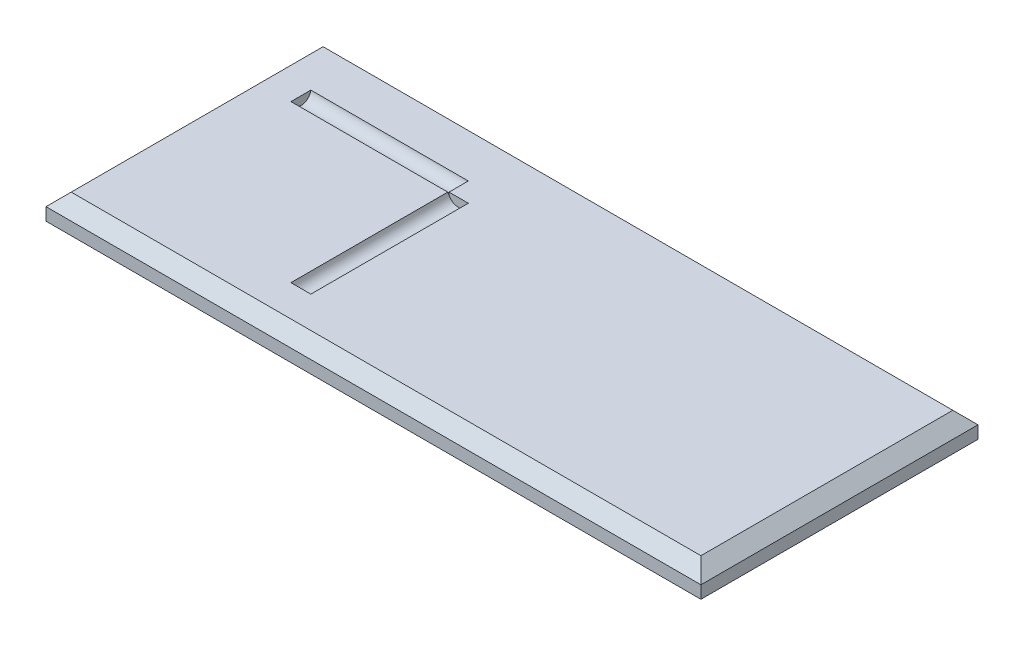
SolidWorks part; units mm, degrees
ref_plane "Front" through (0, 0, 0) normal (0, 0, 1) x (1, 0, 0)
ref_plane "Top" through (0, 0, 0) normal (0, 1, 0) x (1, 0, 0)
ref_plane "Right" through (0, 0, 0) normal (1, 0, 0) x (0, 0, -1)
sketch "Sketch1" plane through (0, 0, 0) normal (0, 0, 1) x (1, 0, 0)
  line L0 (0, 0) -> (330.2, 0)
  line L1 (0, 0) -> (0, 12.7)
  line L2 (330.2, 12.7) -> (0, 12.7)
  line L3 (330.2, 12.7) -> (330.2, 0)
  dimension "D1" = 330.2
  dimension "D2" = 12.7
extrude "Base-Extrude" add sketch "Sketch1" against normal blind 139.7
chamfer "Chamfer1" distance 6.35 angle 45 4 edges at (165.1, 12.7, 0) (165.1, 12.7, -139.7) (330.2, 12.7, -69.85) (0, 12.7, -69.85)
ref_plane "Plane1" through (0, 0, -22.225) normal (0, 0, 1) x (1, 0, 0)
sketch "Sketch2" plane through (0, 0, -22.225) normal (0, 0, 1) x (1, 0, 0)
  line L0 (6.35, 12.7) -> (323.85, 12.7) construction
  line L5 (111.3135, 12.7) -> (101.2783, 12.7)
  arc A2 (101.2783, 12.7) -> (111.3135, 12.7) centre (106.2959, 13.4937) ccw
  dimension "D1" = 5.08
  dimension "D2" = 106.2959
  dimension "D3" = 0.7937
extrude "Cut-Extrude1" cut sketch "Sketch2" against normal blind 79.375
ref_plane "Plane2" through (22.225, 0, 0) normal (-1, 0, 0) x (0, 0, 1)
sketch "Sketch3" plane through (22.225, 0, 0) normal (-1, 0, 0) x (0, 0, 1)
  line L0 (-133.35, 12.7) -> (-6.35, 12.7) construction
  line L1 (-139.7, 0) -> (-139.7, 6.35) construction
  line L2 (-111.3135, 12.7) -> (-101.2783, 12.7)
  arc A1 (-111.3135, 12.7) -> (-101.2783, 12.7) centre (-106.2959, 13.4938) ccw
  dimension "D1" = 5.08
  dimension "D2" = 0.7938
  dimension "D3" = 33.4041
extrude "Cut-Extrude2" cut sketch "Sketch3" against normal blind 79.375
